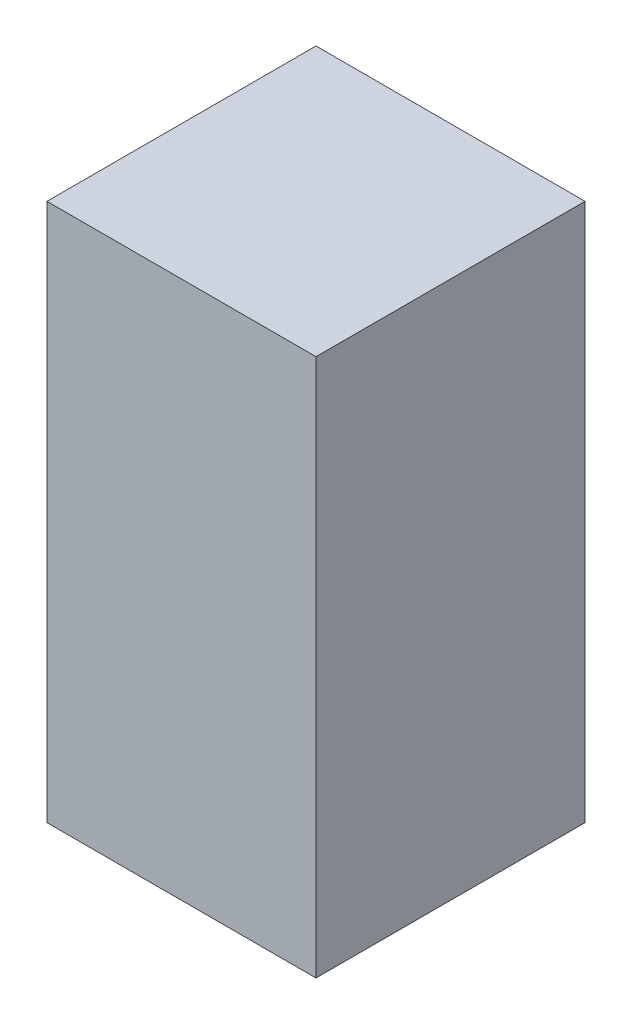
SolidWorks part; units mm, degrees
ref_plane "Front Plane" through (0, 0, 0) normal (0, 0, 1) x (1, 0, 0)
ref_plane "Top Plane" through (0, 0, 0) normal (0, 1, 0) x (1, 0, 0)
ref_plane "Right Plane" through (0, 0, 0) normal (1, 0, 0) x (0, 0, -1)
sketch "Sketch1" plane through (0, 0, 0) normal (0, 1, 0) x (1, 0, 0)
  line L1 (-25.4, 25.4) -> (25.4, 25.4)
  line L2 (-25.4, 25.4) -> (-25.4, -25.4)
  line L3 (-25.4, -25.4) -> (25.4, -25.4)
  line L4 (25.4, 25.4) -> (25.4, -25.4)
  line L5 (-25.4, 25.4) -> (25.4, -25.4) construction
  line L6 (-25.4, -25.4) -> (25.4, 25.4) construction
  point P0 (0, 0)
  dimension "D1" = 50.8
  dimension "D2" = 50.8
extrude "Boss-Extrude1" add sketch "Sketch1" along normal blind 101.6
